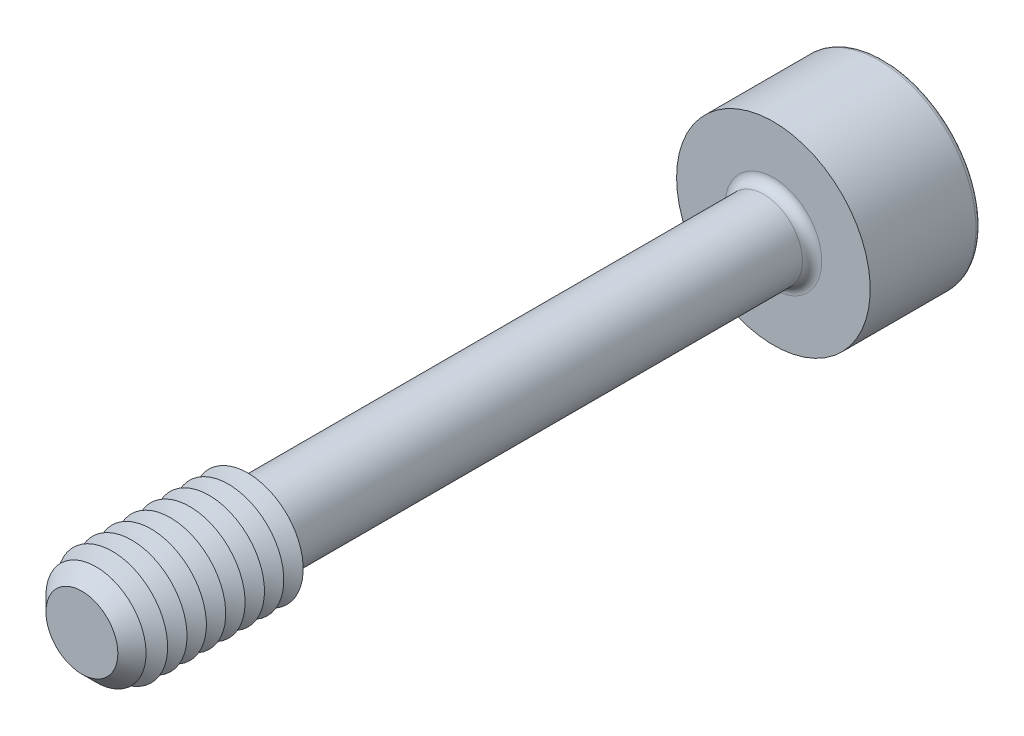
SolidWorks part; units mm, degrees
ref_plane "Front Plane" through (0, 0, 0) normal (0, 0, 1) x (1, 0, 0)
ref_plane "Top Plane" through (0, 0, 0) normal (0, 1, 0) x (1, 0, 0)
ref_plane "Right Plane" through (0, 0, 0) normal (1, 0, 0) x (0, 0, -1)
sketch "Sketch1" plane through (0, 0, 0) normal (0, 0, 1) x (1, 0, 0)
  circle A0 centre (0, 0) radius 1.4
  dimension "D1" = 2.8
extrude "Extrude1" add sketch "Sketch1" along normal mid plane 25
sketch "Sketch2" plane through (0, 0, 0) normal (1, 0, 0) x (0, 0, -1)
  line L0 (-12.5, 0) -> (-12.5, 2)
  line L1 (-12.5, 1.4) -> (-12.5, -1.4) construction
  line L2 (-12.5, 2) -> (-6.5, 2)
  line L3 (-6.5, 2) -> (-6.1536, 1.4)
  line L4 (12.5, 1.4) -> (-12.5, 1.4) construction
  line L5 (-6.1536, 1.4) -> (-6.1536, 0)
  line L6 (-6.1536, 0) -> (-12.5, 0)
  dimension "D1" = 2
  dimension "D2" = 120
  dimension "D3" = 6
revolve "Revolve1" add sketch "Sketch2" angle 360 about L6
chamfer "Chamfer1" distance 0.7 angle 45 1 edges at (0, 2, 12.5)
sketch "Sketch3" plane through (0, 0, -12.5) normal (0, 0, -1) x (-1, 0, 0)
  circle A0 centre (0, 0) radius 3.5
  dimension "D1" = 7
extrude "Extrude2" add sketch "Sketch3" along normal blind 4
sketch "Sketch4" plane through (-13.7, 0, -16.5) normal (0, 0, 1) x (1, 0, 0)
  line L2 (12.834, -1.5) -> (14.566, -1.5)
  line L3 (14.566, -1.5) -> (15.4321, 0)
  line L4 (15.4321, 0) -> (14.566, 1.5)
  line L6 (14.566, 1.5) -> (12.834, 1.5)
  line L7 (12.834, 1.5) -> (11.9679, 0)
  line L8 (11.9679, 0) -> (12.834, -1.5)
  circle A0 centre (13.7, 0) radius 1.5 construction
  dimension "D1" = 3
extrude "Extrude3" cut sketch "Sketch4" along normal blind 3
fillet "Fillet1" radius 0.35 1 edges at (-1.4, 0, -12.5)
fillet "Fillet2" radius 0.175 1 edges at (-3.5, 0, -16.5)
sketch "Sketch5" plane through (0, 0, 0) normal (1, 0, 0) x (0, 0, -1)
  line L0 (13.5, 0) -> (13.5, -1.5)
  line L1 (13.5, -1.5) -> (12.634, 0)
  line L2 (12.634, 0) -> (13.5, 0)
  dimension "D1" = 30
revolve "Cut-Revolve1" cut sketch "Sketch5" angle 360 about L2
sketch "Sketch6" plane through (0, 0, 0) normal (1, 0, 0) x (0, 0, -1)
  line L0 (1.332, 0) -> (-13.289, 0) construction
sketch "Sketch7" plane through (0, 0, 0) normal (1, 0, 0) x (0, 0, -1)
  line L0 (-6.5, 2) -> (-6.85, 1.3938)
  line L1 (-6.85, 1.3938) -> (-7.2, 2)
  line L2 (-6.5, 2) -> (-11.8, 2) construction
  line L3 (-7.2, 2) -> (-6.5, 2)
  dimension "D1" = 0.7
revolve "Cut-Revolve2" cut sketch "Sketch7" angle 360 about L0
pattern_linear "LPattern1" count 8 spacing 0.7 along (0, 0, 1) of "Cut-Revolve2"
